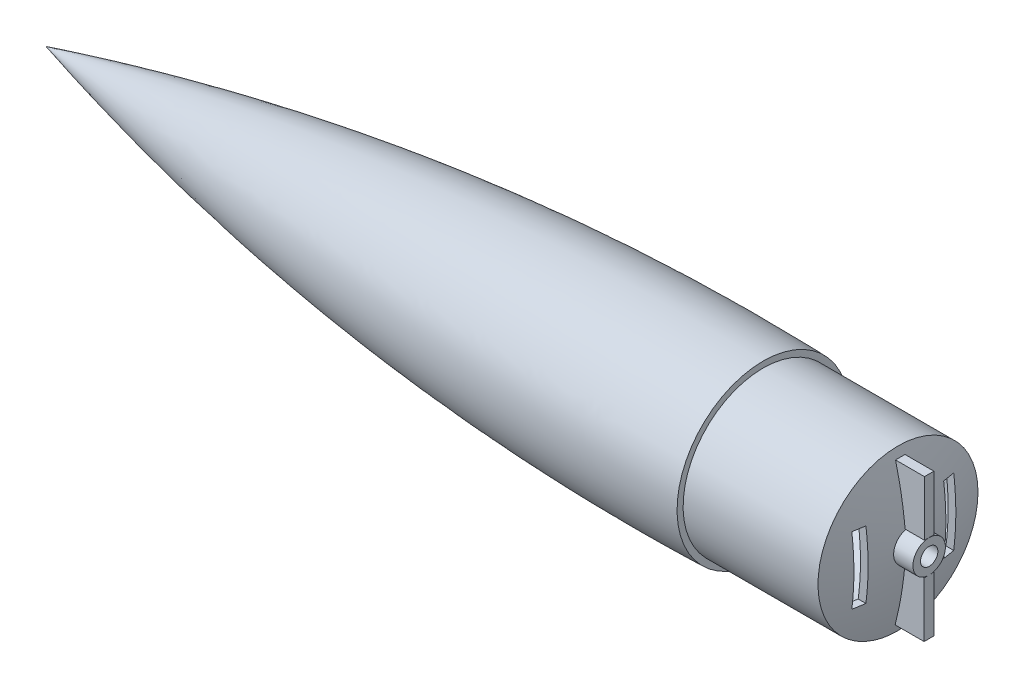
SolidWorks part; units mm, degrees
ref_plane "Front Plane" through (0, 0, 0) normal (0, 0, 1) x (1, 0, 0)
ref_plane "Top Plane" through (0, 0, 0) normal (0, 1, 0) x (1, 0, 0)
ref_plane "Right Plane" through (0, 0, 0) normal (1, 0, 0) x (0, 0, -1)
sketch "Sketch1" plane through (0, 0, 0) normal (0, 0, 1) x (1, 0, 0)
  line L0 (0, 0) -> (0, -2.032)
  line L1 (0, -2.032) -> (49.784, -2.032)
  line L2 (49.784, -2.032) -> (49.784, -28.956)
  line L3 (49.784, -28.956) -> (-241.3, -28.956) construction
  line L4 (49.784, -28.956) -> (-241.3, -28.956)
  arc A0 (0, 0) -> (-241.3, -28.956) centre (-22.0451, -836.1859) ccw
  dimension "D1" = 2.032
  dimension "D2" = 49.784
  dimension "D3" = 28.956
revolve "Revolve1" add sketch "Sketch1" angle 360 about L3
sketch "Sketch17" plane through (0, 0, 0) normal (0, 0, 1) x (1, 0, 0)
  line L0 (-241.3, -28.956) -> (49.784, -28.956) construction
  line L1 (49.784, -55.88) -> (49.784, -2.032) construction
  line L2 (47.3044, -55.7072) -> (82.6125, -66.6944)
  line L3 (82.6125, -66.6944) -> (82.6125, -28.956)
  line L4 (82.6125, -28.956) -> (49.784, -28.956)
  arc A0 (49.784, -28.956) -> (47.3044, -55.7072) centre (-95.758, -28.956) cw
sketch "Sketch22" plane through (0, 0, 0) normal (0, 0, 1) x (1, 0, 0)
  line L0 (49.784, -28.956) -> (67.5791, -28.956)
  line L1 (49.784, -2.032) -> (0, -2.032) construction
  line L2 (45.3869, -2.032) -> (67.5791, 4.171)
  line L3 (67.5791, -28.956) -> (67.5791, 4.171)
  arc A0 (49.784, -28.956) -> (45.3869, -2.032) centre (-73.5622, -35.2795) ccw
revolve "Cut-Revolve7" cut sketch "Sketch22" angle 360 about L0
sketch "Sketch26" plane through (0, 0, 0) normal (1, 0, 0) x (0, 0, -1)
  circle A1 centre (0, -28.956) radius 5.461
  dimension "D1" = 10.922
extrude "Extrude2" add sketch "Sketch26" along normal blind 55.88
shell "Shell2" thickness 2.54
sketch "Sketch27" plane through (0, 0, 0) normal (1, 0, 0) x (0, 0, -1)
  line L0 (0, -28.956) -> (-38.6172, -28.956) construction
  line L1 (-17.145, -17.653) -> (-13.081, -17.653)
  line L2 (-17.145, -17.653) -> (-17.145, -40.259)
  line L3 (-17.145, -40.259) -> (-13.081, -40.259)
  line L4 (-13.081, -17.653) -> (-13.081, -40.259)
  line L5 (0, -28.956) -> (25.5064, -28.956) construction
  line L7 (13.081, -17.653) -> (17.145, -17.653)
  line L8 (13.081, -17.653) -> (13.081, -40.259)
  line L9 (13.081, -40.259) -> (17.145, -40.259)
  line L10 (17.145, -17.653) -> (17.145, -40.259)
  circle A0 centre (0, -35.56) radius 5.461 construction
  dimension "D1" = 13.081
  dimension "D2" = 4.064
  dimension "D3" = 22.606
  dimension "D4" = 4.064
  dimension "D5" = 22.606
  dimension "D6" = 13.081
sketch "Sketch28" plane through (55.88, 0, 0) normal (1, 0, 0) x (0, 0, -1)
  line L1 (-1.7145, -52.9513) -> (1.5875, -52.9513)
  line L2 (-1.5875, -23.4836) -> (1.5875, -23.4836)
  line L3 (-1.5875, -23.4836) -> (-1.5875, -4.9416)
  line L4 (-1.5875, -4.9416) -> (1.5875, -4.9416)
  line L5 (1.5875, -23.4836) -> (1.5875, -4.9416)
  line L6 (-1.7145, -52.9513) -> (-1.7145, -34.4093)
  line L7 (-1.7145, -34.4093) -> (1.5875, -34.4093)
  line L8 (1.5875, -52.9513) -> (1.5875, -34.4093)
  dimension "D2" = 3.175
  dimension "D1" = 18.542
  dimension "D3" = 18.542
  dimension "D4" = 3.302
extrude "Extrude3" add sketch "Sketch28" against normal blind 10.16
extrude "Cut-Extrude3" cut sketch "Sketch27" along normal blind 101.6
